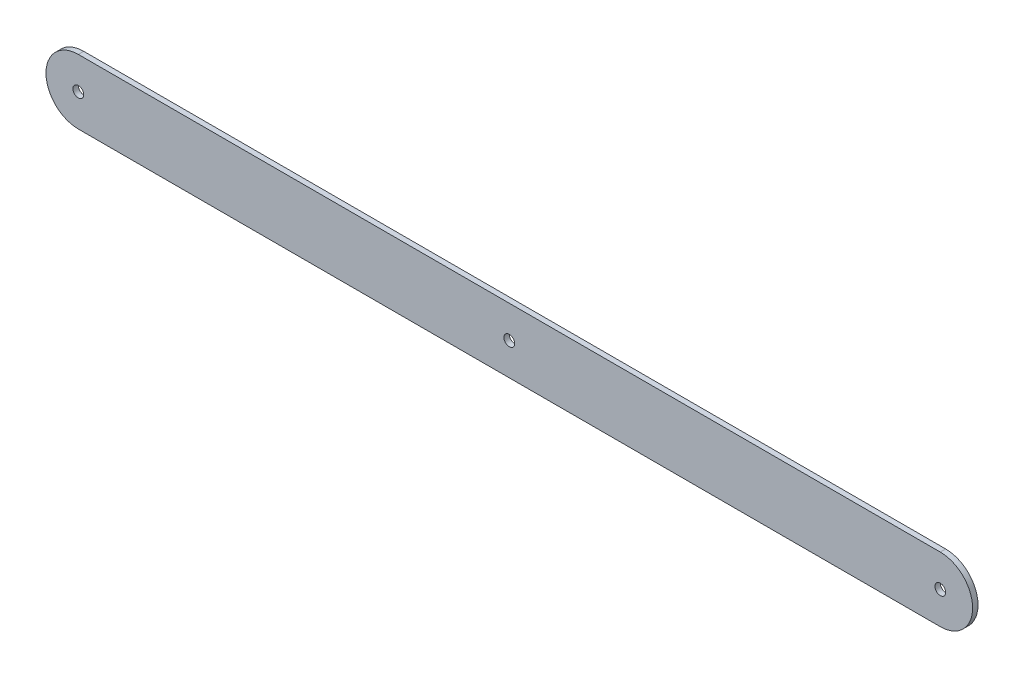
SolidWorks part; units mm, degrees
ref_plane "Front Plane" through (0, 0, 0) normal (0, 0, 1) x (1, 0, 0)
ref_plane "Top Plane" through (0, 0, 0) normal (0, 1, 0) x (1, 0, 0)
ref_plane "Right Plane" through (0, 0, 0) normal (1, 0, 0) x (0, 0, -1)
sketch "Sketch3" plane through (0, 0, 0) normal (0, 0, 1) x (1, 0, 0)
  line L0 (0, 0) -> (160, 0) construction
  line L1 (0.55, 0) -> (-0.55, 0) construction
  line L2 (0, 6) -> (160, 6)
  line L3 (0, -6) -> (160, -6)
  arc A0 (0, 6) -> (0, -6) centre (0, 0) ccw
  arc A1 (160, -6) -> (160, 6) centre (160, 0) ccw
  circle A2 centre (80, 0) radius 1
  point P5 (80, 0)
  point P12 (9, 0)
  dimension "D2" = 6
  dimension "D3" = 2
  dimension "D1" = 160
  dimension "D4" = 9
extrude "Boss-Extrude1" add sketch "Sketch3" along normal blind 1
sketch "Sketch4" plane through (0, 0, 0) normal (0, 0, 1) x (1, 0, 0)
  circle A0 centre (0, 0) radius 1
  circle A1 centre (160, 0) radius 1
  dimension "D1" = 2
  dimension "D2" = 2
extrude "Cut-Extrude1" cut sketch "Sketch4" along normal through all contours A0 | A1
